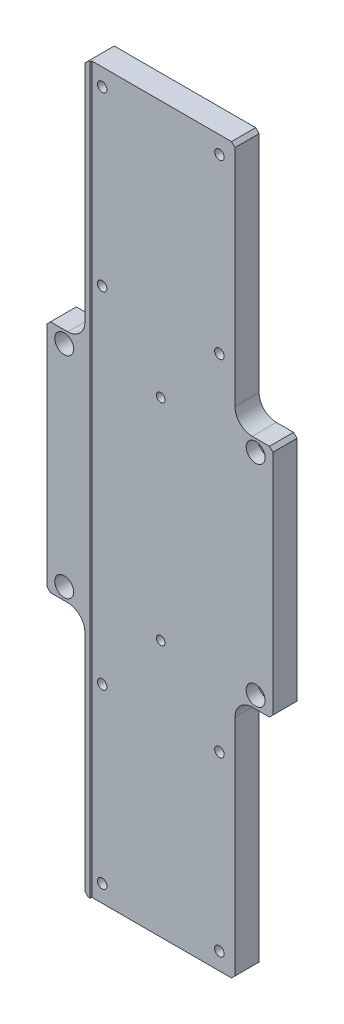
SolidWorks part; units mm, degrees
ref_plane "정면" through (0, 0, 0) normal (0, 0, 1) x (1, 0, 0)
ref_plane "윗면" through (0, 0, 0) normal (0, 1, 0) x (1, 0, 0)
ref_plane "우측면" through (0, 0, 0) normal (1, 0, 0) x (0, 0, -1)
sketch "스케치1" plane through (0, 0, 0) normal (0, 0, 1) x (1, 0, 0)
  line L1 (-65, 68) -> (65, 68)
  line L2 (-65, 68) -> (-65, -68)
  line L3 (-65, -68) -> (65, -68)
  line L4 (65, 68) -> (65, -68)
  line L5 (-43, 210) -> (43, 210)
  line L6 (-43, 210) -> (-43, -210)
  line L7 (-43, -210) -> (43, -210)
  line L8 (43, 210) -> (43, -210)
  line L9 (-43, 210) -> (43, -210) construction
  line L10 (-43, -210) -> (43, 210) construction
  point P4 (0, 0)
  dimension "D1" = 86
  dimension "D2" = 22
  dimension "D3" = 22
  dimension "D4" = 136
  dimension "D5" = 142
  dimension "D6" = 142
extrude "보스-돌출1" add sketch "스케치1" along normal mid plane 15 contours L8 L5 L6 L1 | L6 L1 L2 L3 | L8 L1 L6 L3 | L1 L8 L3 L4 | L8 L3 L6 L7
sketch "스케치2" plane through (0, 0, 7.5) normal (0, 0, 1) x (1, 0, 0)
  line L0 (-43, 210) -> (43, 210) construction
  line L1 (65, 68) -> (65, -68) construction
  line L2 (-40, 210) -> (65, 210)
  line L3 (-40, 210) -> (-40, -210)
  line L4 (-40, -210) -> (65, -210)
  line L5 (65, 210) -> (65, -210)
  line L6 (-43, -210) -> (43, -210) construction
  line L7 (-65, 68) -> (-65, -68) construction
  dimension "D1" = 25
extrude "컷-돌출1" cut sketch "스케치2" against normal blind 1
hole_wizard "Ø5.0mm 맞춤핀 구멍1" positions "스케치3" profile "스케치4" hole size "Ø5.0" standard "ISO"
sketch "스케치3" plane through (0, 0, 6.5) normal (0, 0, 1) x (1, 0, 0)
  line L0 (0, 0) -> (0, 229.5692) construction
  line L1 (43, 210) -> (-40, 210) construction
  point P6 (0, 61)
  point P8 (0, -61)
  dimension "D1" = 149
  dimension "D2" = 122
sketch "스케치4" plane through (0, -61, 6.5) normal (1, 0, 0) x (0, -1, 0)
  line L0 (0, 0) -> (0, 14)
  line L1 (0, 14) -> (2.5, 14)
  line L2 (2.5, 14) -> (2.5, 0)
  line L5 (2.5, 0) -> (0, 0)
  line L11 (0, -6.35) -> (0, 107.95) construction
  dimension "관통 구멍 지름" = 5
  dimension "관통 구멍 깊이" = 14
hole_wizard "M6 소켓 머리 캡 나사용 카운터보어1" positions "스케치5" profile "스케치6" counterbore size "M6" standard "KS"
sketch "스케치5" plane through (0, 0, 7.5) normal (0, 0, 1) x (1, 0, 0)
  line L0 (43, 210) -> (-40, 210) construction
  line L3 (-65, 68) -> (-65, -68) construction
  point P0 (-55, 61)
  point P2 (-55, -61)
  point P4 (55, 61)
  point P6 (55, -61)
  dimension "D1" = 122
  dimension "D2" = 149
  dimension "D3" = 10
  dimension "D4" = 110
sketch "스케치6" plane through (-55, 61, 7.5) normal (1, 0, 0) x (0, -1, 0)
  line L0 (0, 0) -> (0, 15)
  line L1 (0, 15) -> (3.3, 15)
  line L3 (3.3, 15) -> (3.3, 8)
  line L4 (3.3, 8) -> (5.5, 8)
  line L5 (5.5, 8) -> (5.5, 0)
  line L7 (5.5, 0) -> (0, 0)
  line L11 (0, -6.35) -> (0, 107.95) construction
  dimension "관통 구멍 지름" = 6.6
  dimension "관통 구멍 깊이" = 15
  dimension "카운터보어 지름" = 11
  dimension "카운터보어 깊이" = 8
hole_wizard "M5 소켓 머리 캡 나사용 카운터보어1" positions "스케치7" profile "스케치8" counterbore size "M5" standard "KS"
sketch "스케치7" plane through (0, 0, -7.5) normal (0, 0, -1) x (-1, 0, 0)
  line L0 (43, 210) -> (-43, 210) construction
  line L1 (-43, 210) -> (-43, 68) construction
  point P0 (-34, 200)
  point P2 (34, 200)
  point P4 (-34, 100)
  point P6 (34, 100)
  dimension "D1" = 100
  dimension "D2" = 10
  dimension "D3" = 9
  dimension "D4" = 68
sketch "스케치8" plane through (34, 200, -7.5) normal (1, 0, 0) x (0, 1, 0)
  line L0 (0, 0) -> (0, 15)
  line L1 (0, 15) -> (2.75, 15)
  line L3 (2.75, 15) -> (2.75, 7)
  line L4 (2.75, 7) -> (4.75, 7)
  line L5 (4.75, 7) -> (4.75, 0)
  line L7 (4.75, 0) -> (0, 0)
  line L11 (0, -6.35) -> (0, 107.95) construction
  dimension "관통 구멍 지름" = 5.5
  dimension "관통 구멍 깊이" = 15
  dimension "카운터보어 지름" = 9.5
  dimension "카운터보어 깊이" = 7
pattern_linear "선형 패턴1" count 2 spacing 300 along (0, -1, 0) of "M5 소켓 머리 캡 나사용 카운터보어1"
fillet "필렛1" radius 10 4 edges at (-43, 68, 0) (43, 68, -0.5) (43, -68, -0.5) (-43, -68, 0)
chamfer "모따기1" distance 2 angle 45 8 edges at (-65, 68, 0) (-65, -68, 0) (-43, -210, 0) (43, -210, -0.5) (65, -68, -0.5) (65, 68, -0.5) (-43, 210, 0) (43, 210, -0.5)
